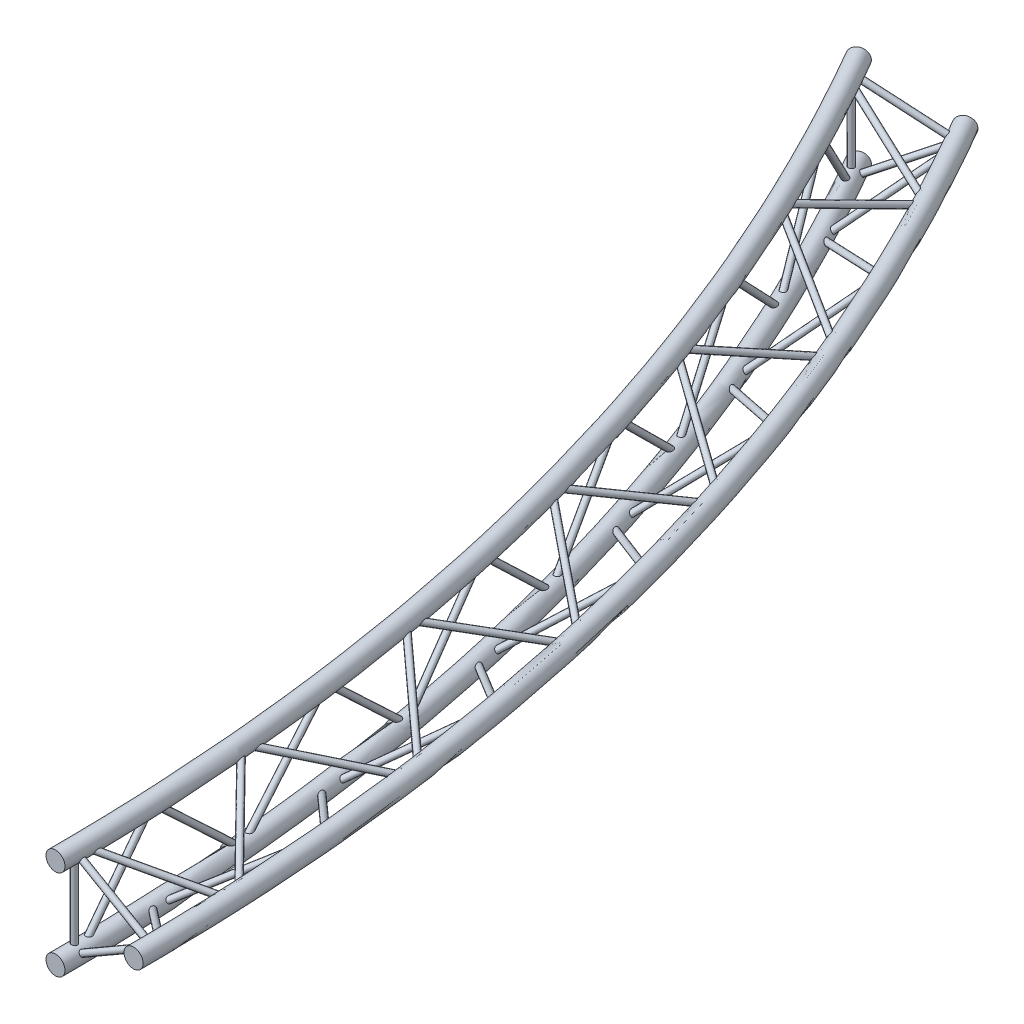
SolidWorks part; units mm, degrees
ref_plane "Face" through (0, 0, 0) normal (0, 0, 1) x (1, 0, 0)
ref_plane "Dessus" through (0, 0, 0) normal (0, 1, 0) x (1, 0, 0)
ref_plane "Droite" through (0, 0, 0) normal (1, 0, 0) x (0, 0, -1)
sketch "Esquisse1" plane through (0, 0, 0) normal (0, 0, 1) x (1, 0, 0)
  line L0 (5769.752, 118.5) -> (5769.752, -118.5) construction
  line L1 (5769.752, -118.5) -> (5975, 0) construction
  line L2 (5975, 0) -> (5769.752, 118.5) construction
  line L3 (5838.168, 61.5908) -> (5838.168, -61.5908) construction
  line L4 (72.9361, 0) -> (11603.3998, 0) construction
  line L5 (5838.168, 0) -> (5769.752, 118.5)
  line L8 (6000, 0) -> (6000, 276.3926) construction
  line L9 (0, 252.4415) -> (0, -235.2114) construction
  circle A0 centre (5838.168, 0) radius 136.832 construction
  circle A1 centre (5769.752, 118.5) radius 25
  circle A2 centre (5769.752, -118.5) radius 25
  circle A3 centre (5975, 0) radius 25
  dimension "D1" = 120
  dimension "D2" = 50
  dimension "D3" = 237
  dimension "D4" = 6000
revolve "Révolution1" add sketch "Esquisse1" angle 30 about L9
ref_point "Point1"
ref_plane "Plan1" through (0, -118.5, 0) normal (0, 1, 0) x (-1, 0, 0)
sketch "cercle1" plane through (0, -118.5, 0) normal (0, 1, 0) x (-1, 0, 0)
  circle A0 centre (0, 0) radius 5769.752
ref_point "Point2"
ref_plane "Plan2" through (0, 0, 0) normal (0, 1, 0) x (-1, 0, 0)
sketch "cercle2" plane through (0, 0, 0) normal (0, 1, 0) x (-1, 0, 0)
  circle A0 centre (0, 0) radius 5975
ref_point "Point3"
ref_plane "Plan3" through (0, 118.5, 0) normal (0, 1, 0) x (-1, 0, 0)
sketch "cercle3" plane through (0, 118.5, 0) normal (0, 1, 0) x (-1, 0, 0)
  circle A0 centre (0, 0) radius 5769.752
ref_point "Point4"
ref_plane "Plan4" through (0, 0, 0) normal (0, 1, 0) x (-1, 0, 0)
sketch "cercle4" plane through (0, 0, 0) normal (0, 1, 0) x (-1, 0, 0)
  circle A0 centre (0, 0) radius 5838.168
ref_plane "plan_sym" through (0, 0, 0) normal (0.2588, 0, 0.9659) x (0.9659, 0, -0.2588)
sketch3d "Esquisse3D1"
  line L0 (5769.5353, 118.5, -49.9995) -> (5769.5353, -118.5, -49.9999)
  line L1 (5769.5353, -118.5, -49.9999) -> (5974.7908, 0, -49.9996)
  line L2 (5974.7908, 0, -49.9996) -> (5769.5353, 118.5, -49.9995)
  line L3 (5769.752, -118.5, 0) -> (5975, 0, 0) construction
  circle A0 centre (0, 118.5, 0) radius 5769.752 construction
  circle A1 centre (0, -118.5, 0) radius 5769.752 construction
  circle A2 centre (0, 0, 0) radius 5975 construction
  circle A3 centre (5769.752, 118.5, 0) radius 25 construction
  point P4 (0, 5888.252, 0)
  point P7 (0, 5651.252, 0)
  point P11 (0, 5975, 0)
  point P14 (5769.752, 118.5, 25)
  dimension "D1" = 50
  dimension "D2" = 50
  dimension "D3" = 50
ref_plane "Plan6" through (5769.5353, -118.5, -49.9999) normal (0, -1, 0) x (1, 0, 0)
sketch "Esquisse8" plane through (5769.5353, -118.5, -49.9999) normal (0, -1, 0) x (1, 0, 0)
  circle A0 centre (0, 0) radius 8
sweep "treilli droit départ" add profiles "Esquisse8" path "Esquisse3D1"
mirror "treilli droit fin" about plane through (0, 0, 0) normal (0.2588, 0, 0.9659) of "treilli droit départ"
sketch3d "Esquisse3D2"
  line L0 (5974.59, 0, -69.9988) -> (5763.8933, -118.5, -259.9465)
  line L1 (5769.752, -118.5, 0) -> (5975, 0, 0) construction
  circle A0 centre (0, 0, 0) radius 5975 construction
  circle A1 centre (0, -118.5, 0) radius 5769.752 construction
  point P4 (0, 5975, 0)
  point P7 (0, 5651.252, 0)
  dimension "D1" = 70
  dimension "D2" = 259.963
ref_plane "Plan7" through (5763.8933, -118.5, -259.9465) normal (-0.6853, -0.3854, -0.6178) x (-0.6596, -0.0311, 0.751)
sketch "Esquisse9" plane through (5763.8933, -118.5, -259.9465) normal (-0.6853, -0.3854, -0.6178) x (-0.6596, -0.0311, 0.751)
  circle A0 centre (0, 0) radius 8
  dimension "D1" = 16
sweep "treilli depart 1" add profiles "Esquisse9" path "Esquisse3D2"
sketch3d "Esquisse3D3"
  line L0 (5769.3274, -118.5, -69.9987) -> (5763.8955, 118.5, -259.897)
  circle A0 centre (0, -118.5, 0) radius 5769.752 construction
  circle A1 centre (0, 118.5, 0) radius 5769.752 construction
  point P4 (0, 5651.252, 0)
  point P7 (0, 5888.252, 0)
  dimension "D1" = 70
  dimension "D2" = 259.963
ref_plane "Plan8" through (5769.3274, -118.5, -69.9987) normal (-0.0179, 0.7803, -0.6252) x (-0.9995, 0.0027, 0.032)
sketch "Esquisse10" plane through (5769.3274, -118.5, -69.9987) normal (-0.0179, 0.7803, -0.6252) x (-0.9995, 0.0027, 0.032)
  circle A0 centre (0, 0) radius 8
  dimension "D1" = 16
sweep "treilli depart 2" add profiles "Esquisse10" path "Esquisse3D3"
sketch3d "Esquisse3D4"
  line L0 (5769.3274, 118.5, -69.9987) -> (5969.3447, 0, -259.9015)
  circle A0 centre (0, 118.5, 0) radius 5769.752 construction
  circle A1 centre (0, 0, 0) radius 5975 construction
  point P4 (0, 5888.252, 0)
  point P7 (0, 5975, 0)
  dimension "D1" = 259.963
  dimension "D2" = 70
ref_plane "Plan9" through (5969.3447, 0, -259.9015) normal (0.6663, -0.3948, -0.6326) x (0.7339, 0.4975, 0.4625)
sketch "Esquisse11" plane through (5969.3447, 0, -259.9015) normal (0.6663, -0.3948, -0.6326) x (0.7339, 0.4975, 0.4625)
  circle A0 centre (0, 0) radius 8
  dimension "D1" = 16
sweep "treilli depart 3" add profiles "Esquisse11" path "Esquisse3D4"
mirror "treillis fin" about plane through (0, 0, 0) normal (0.2588, 0, 0.9659) of "treilli depart 1", "treilli depart 2", "treilli depart 3"
sketch3d "Esquisse3D6"
  line L0 (5763.8955, 118.5, -259.897) -> (5747.0418, -118.5, -511.4183)
  line L1 (5764.5712, 89.0195, -236.2755) -> (5768.8551, -97.8962, -86.5077) construction
  circle A0 centre (0, 118.5, 0) radius 5769.752 construction
  circle A1 centre (0, -118.5, 0) radius 5769.752 construction
  point P4 (0, 5888.252, 0)
  point P7 (0, 5651.252, 0)
  dimension "D1" = 346
ref_plane "Plan11" through (5747.0418, -118.5, -511.4183) normal (-0.0487, -0.685, -0.7269) x (0.9971, -0.0758, 0.0046)
sketch "Esquisse12" plane through (5747.0418, -118.5, -511.4183) normal (-0.0487, -0.685, -0.7269) x (0.9971, -0.0758, 0.0046)
  circle A0 centre (0, 0) radius 8
  dimension "D1" = 16
sweep "treilli int 1" add profiles "Esquisse12" path "Esquisse3D6"
ref_plane "Plan10" through (0, 0, 0) normal (0.0886, 0, 0.9961) x (0.9961, 0, -0.0886)
sketch3d "Esquisse3D7"
  line L2 (5968.2554, 0, -283.8187) -> (5747.0418, 118.5, -511.4183)
  circle A0 centre (0, 118.5, 0) radius 5769.752 construction
  circle A1 centre (0, 0, 0) radius 5975 construction
  point P4 (0, 5888.252, 0)
  point P5 (0, 5975, 0)
  dimension "D1" = 338.7909
ref_plane "Plan12" through (5747.0418, 118.5, -511.4183) normal (-0.653, 0.3498, -0.6718) x (-0.7477, -0.4392, 0.4981)
sketch "Esquisse13" plane through (5747.0418, 118.5, -511.4183) normal (-0.653, 0.3498, -0.6718) x (-0.7477, -0.4392, 0.4981)
  circle A0 centre (0, 0) radius 8
  dimension "D1" = 16
sweep "treilli int 2" add profiles "Esquisse13" path "Esquisse3D7"
sketch3d "Esquisse3D9"
  line L0 (5763.8933, -118.5, -259.9465) -> (5951.4819, 0, -529.611)
  line L1 (5957.0158, -9.8841, -85.8423) -> (5787.9086, -104.9933, -238.2962) construction
  circle A0 centre (0, -118.5, 0) radius 5769.752 construction
  circle A1 centre (0, 0, 0) radius 5975 construction
  point P4 (0, 5651.252, 0)
  point P7 (0, 5975, 0)
  dimension "D2" = 349.2144
ref_plane "Plan13" through (5763.8933, -118.5, -259.9465) normal (0.5372, 0.3393, -0.7722) x (-0.8245, 0.018, -0.5656)
sketch "Esquisse14" plane through (5763.8933, -118.5, -259.9465) normal (0.5372, 0.3393, -0.7722) x (-0.8245, 0.018, -0.5656)
  circle A0 centre (0, 0) radius 8
  dimension "D1" = 16
sweep "treilli int 3" add profiles "Esquisse14" path "Esquisse3D9"
sketch3d "Esquisse3D10"
  line L0 (5719.2176, 118.5, -761.9633) -> (5747.0418, -118.5, -511.4183)
  circle A0 centre (0, 118.5, 0) radius 5769.752 construction
  circle A1 centre (0, -118.5, 0) radius 5769.752 construction
  point P4 (0, 5888.252, 0)
  point P7 (0, 5651.252, 0)
  dimension "D1" = 346
ref_plane "Plan14" through (5719.2176, 118.5, -761.9633) normal (0.0804, -0.685, 0.7241) x (0.9769, 0.1985, 0.0793)
sketch "Esquisse15" plane through (5719.2176, 118.5, -761.9633) normal (0.0804, -0.685, 0.7241) x (0.9769, 0.1985, 0.0793)
  circle A0 centre (0, 0) radius 8
  dimension "D1" = 16
sweep "treilli int4" add profiles "Esquisse15" path "Esquisse3D10"
sketch3d "Esquisse3D11"
  line L0 (5747.0418, 118.5, -511.4183) -> (5924.5903, 0, -774.503)
  circle A0 centre (0, 0, 0) radius 5975 construction
  point P5 (0, 5975, 0)
  dimension "D1" = 338.7909
ref_plane "Plan15" through (5924.5903, 0, -774.503) normal (0.5241, -0.3498, -0.7765) x (-0.848, -0.13, -0.5138)
sketch "Esquisse16" plane through (5924.5903, 0, -774.503) normal (0.5241, -0.3498, -0.7765) x (-0.848, -0.13, -0.5138)
  circle A0 centre (0, 0) radius 8
  dimension "D1" = 16
sweep "treilli int 5" add profiles "Esquisse16" path "Esquisse3D11"
sketch3d "Esquisse3D12"
  line L0 (5951.4819, 0, -529.611) -> (5721.0739, -118.5, -747.8979)
  circle A0 centre (0, -118.5, 0) radius 5769.752 construction
  point P5 (0, 5651.252, 0)
  dimension "D1" = 338.7909
ref_plane "Plan16" through (5951.4819, 0, -529.611) normal (-0.6801, -0.3498, -0.6443) x (-0.6576, -0.0975, 0.747)
sketch "Esquisse17" plane through (5951.4819, 0, -529.611) normal (-0.6801, -0.3498, -0.6443) x (-0.6576, -0.0975, 0.747)
  circle A0 centre (0, 0) radius 8
  dimension "D1" = 16
sweep "treilli int 6" add profiles "Esquisse17" path "Esquisse3D12"
sketch "Esquisse19" plane through (0, 0, 0) normal (0, 1, 0) x (1, 0, 0)
  line L0 (5747.0418, 511.4183) -> (0, 0)
  line L1 (0, 0) -> (5763.8955, 259.897)
  line L2 (5764.5712, 236.2755) -> (5768.8551, 86.5077) construction
  line L3 (-267.1534, -23.7735) -> (267.1534, 23.7735) construction
  line L4 (5762.3865, 282.4176) -> (5749.1956, 479.2756) construction
  circle A1 centre (0, 0) radius 5769.752 construction
  circle A2 centre (0, 0) radius 5769.752 construction
  dimension "D1" = 2.503
pattern_circular "Répétition circulaire1" count 5 every 5.007 of "treilli int 1", "treilli int 3", "treilli int 2"
pattern_circular "Répétition circulaire2" count 5 every 5.007 of "treilli int4", "treilli int 6", "treilli int 5"
sketch3d "Esquisse3D13"
  line L0 (5031.384, 118.5, -2824.0419) -> (5121.6589, -118.5, -2656.8117)
  circle A0 centre (0, 118.5, 0) radius 5769.752 construction
  circle A1 centre (0, -118.5, 0) radius 5769.752 construction
  point P4 (0, 5888.252, 0)
  point P7 (0, 5651.252, 0)
  dimension "D1" = 259.963
  dimension "D2" = 70
ref_plane "Plan17" through (5031.384, 118.5, -2824.0419) normal (0.2972, -0.7802, 0.5505) x (0.5352, 0.6136, 0.5806)
sketch "Esquisse21" plane through (5031.384, 118.5, -2824.0419) normal (0.2972, -0.7802, 0.5505) x (0.5352, 0.6136, 0.5806)
  circle A0 centre (0, 0) radius 8
  dimension "D1" = 16
sweep "treilli sym 1" [suppressed] add profiles "Esquisse21" path "Esquisse3D13"
sketch3d "Esquisse3D14"
  line L0 (5121.6589, 118.5, -2656.8117) -> (5209.1467, 0, -2926.6732)
  circle A0 centre (0, 118.5, 0) radius 5769.752 construction
  circle A1 centre (0, 0, 0) radius 5975 construction
  point P4 (0, 5888.252, 0)
  point P7 (0, 5975, 0)
  dimension "D1" = 70
  dimension "D2" = 259.963
ref_plane "Plan18" [suppressed] through (2506.195, 0, -2407.2) normal (-0.0436, -0.342, -0.9387) x (0.3371, -0.8895, 0.3084)
sketch "Esquisse22" [suppressed] plane through (2506.195, 0, -2407.2) normal (-0.0436, -0.342, -0.9387) x (0.3371, -0.8895, 0.3084)
  circle A0 centre (-5.0885, 0) radius 8
  dimension "D1" = 16
sweep "treilli sym 2" [suppressed] add profiles "Esquisse22" path "Esquisse3D14"
sketch3d "Esquisse3D15"
  line L0 (5039.6534, 0, -3209.7536) -> (5031.384, -118.5, -2824.0419)
  circle A0 centre (0, 0, 0) radius 5975 construction
  circle A1 centre (0, -118.5, 0) radius 5769.752 construction
  circle A3 centre (5174.5018, 0, -2987.5) radius 25 construction
  point P4 (0, 5975, 0)
  point P7 (0, 5651.252, 0)
  point P13 (5187.0018, 0, -2965.8494)
  dimension "D1" = 70
  dimension "D2" = 259.963
ref_plane "Plan19" [suppressed] through (2227.8985, 0, -2666.8508) normal (0.301, -0.2679, 0.9152) x (0.8918, 0.4191, -0.1706)
sketch "Esquisse23" [suppressed] plane through (2227.8985, 0, -2666.8508) normal (0.301, -0.2679, 0.9152) x (0.8918, 0.4191, -0.1706)
  circle A0 centre (0, 0) radius 8
  dimension "D1" = 16
sweep "treilli sym 3" [suppressed] add profiles "Esquisse23" path "Esquisse3D15"
equation "\"D1@plan_sym\"=\"D1@Révolution1\"/2"
equation "\"pas_theorique\"=500"
equation "\"demi_pas_theorique\"=\"pas_theorique\"/2"
equation "\"nb_demi_pas_theorique\"=(2*\"D4@Esquisse1\"* pi -2*70)/(\"demi_pas_theorique\")"
equation "\"nb_arche\"=360/\"D1@Révolution1\""
equation "\"nb_demi_pas_th_2\"=\"nb_demi_pas_theorique\"/\"nb_arche\""
equation "\"nb_demi_pas_entier\"=int(\"nb_demi_pas_th_2\")-1"
equation "\"D2@Esquisse3D2\" = 70+(\"nb_demi_pas_th_2\"-\"nb_demi_pas_entier\")*\"pas_theorique\"/4"
equation "\"D2@Esquisse3D3\" = \"D2@Esquisse3D2\""
equation "\"D1@Esquisse3D4\"=\"D2@Esquisse3D2\""
equation "\"D1@Esquisse3D10\" = \"D1@Esquisse3D6\""
equation "\"D1@Esquisse3D11\" = \"D1@Esquisse3D7\""
equation "\"D1@Esquisse3D12\" = \"D1@Esquisse3D9\""
equation "\"D2@Répétition circulaire1\"=\"D1@Esquisse19\"*2"
equation "\"D1@Esquisse3D13\" = \"D2@Esquisse3D2\""
equation "\"D2@Esquisse3D14\" = \"D1@Esquisse3D4\""
equation "\"D2@Esquisse3D15\" = \"D2@Esquisse3D3\""
equation "\"D2@Répétition circulaire2\" = \"D1@Esquisse19\"*2"
equation "\"D1@Esquisse3D7\" = \"D1@Esquisse3D9\""
